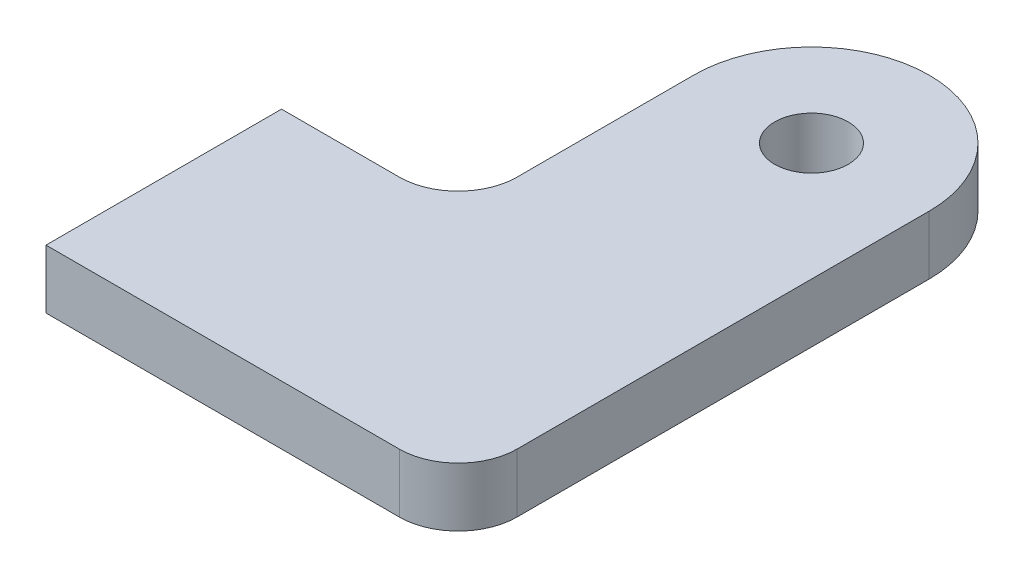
SolidWorks part; units mm, degrees
ref_plane "FRONT" through (0, 0, 0) normal (0, 0, 1) x (1, 0, 0)
ref_plane "TOP" through (0, 0, 0) normal (0, 1, 0) x (1, 0, 0)
ref_plane "RIGHT" through (0, 0, 0) normal (1, 0, 0) x (0, 0, -1)
sketch "Sketch1" plane through (0, 0, 0) normal (0, 1, 0) x (1, 0, 0)
  line L0 (0, 25.4) -> (12.7, 25.4)
  line L1 (19.05, 31.75) -> (19.05, 50.8)
  line L2 (44.45, 50.8) -> (44.45, 6.35)
  line L3 (38.1, 0) -> (0, 0)
  line L4 (0, 25.4) -> (0, 0)
  circle A0 centre (31.75, 50.8) radius 3.9687
  arc A1 (19.05, 50.8) -> (44.45, 50.8) centre (31.75, 50.8) cw
  arc A2 (12.7, 25.4) -> (19.05, 31.75) centre (12.7, 31.75) ccw
  arc A3 (38.1, 0) -> (44.45, 6.35) centre (38.1, 6.35) ccw
  dimension "D1" = 44.45
  dimension "D2" = 6.35
  dimension "D4" = 63.5
  dimension "D5" = 12.7
  dimension "D6" = 7.9375
  dimension "D3" = 25.4
extrude "Extrude1" add sketch "Sketch1" along normal blind 6.35
